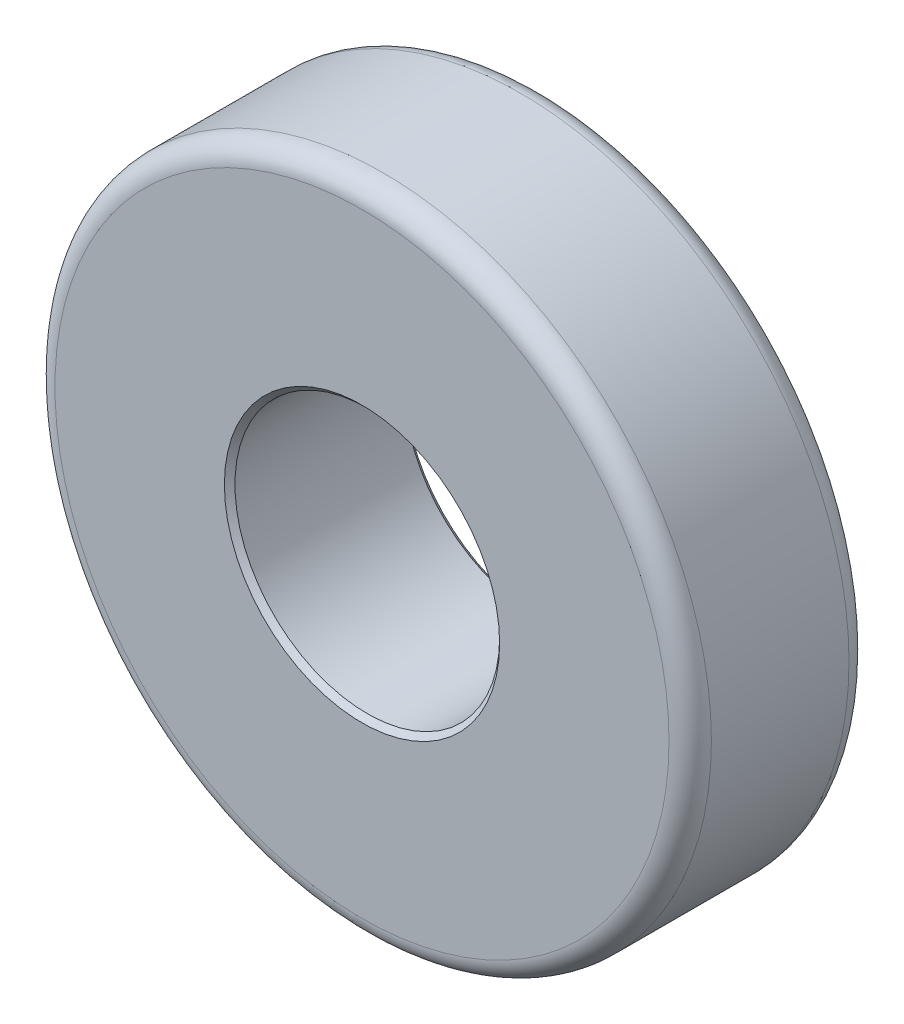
SolidWorks part; units mm, degrees
ref_plane "Front Plane" through (0, 0, 0) normal (0, 0, 1) x (1, 0, 0)
ref_plane "Top Plane" through (0, 0, 0) normal (0, 1, 0) x (1, 0, 0)
ref_plane "Right Plane" through (0, 0, 0) normal (1, 0, 0) x (0, 0, -1)
sketch "Sketch1" plane through (0, 0, 0) normal (0, 0, 1) x (1, 0, 0)
  circle A0 centre (0, 0) radius 31
  circle A1 centre (0, 0) radius 12.5
  dimension "D1" = 25
  dimension "D2" = 62
extrude "Extrude1" add sketch "Sketch1" along normal blind 17
fillet "Fillet1" radius 2 2 edges at (31, 0, 0) (31, 0, 17)
chamfer "Chamfer1" distance 0.5 angle 45 2 edges at (12.5, 0, 0) (12.5, 0, 17)
